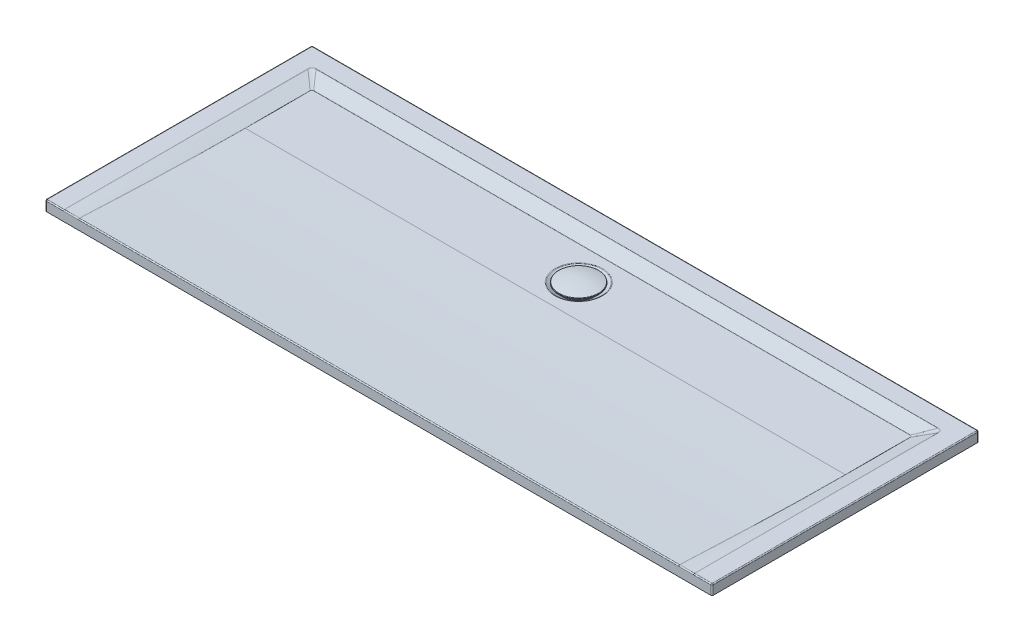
SolidWorks part; units mm, degrees
ref_plane "Płaszczyzna przednia" through (0, 0, 0) normal (0, 0, 1) x (1, 0, 0)
ref_plane "Płaszczyzna górna" through (0, 0, 0) normal (0, 1, 0) x (1, 0, 0)
ref_plane "Płaszczyzna prawa" through (0, 0, 0) normal (1, 0, 0) x (0, 0, -1)
sketch "Szkic1" plane through (0, 0, 0) normal (0, 1, 0) x (1, 0, 0)
  line L0 (0, 400) -> (0, -400) construction
  line L1 (-1000, 400) -> (1000, 400)
  line L2 (-1000, 400) -> (-1000, -400)
  line L3 (-1000, -400) -> (1000, -400)
  line L4 (1000, 400) -> (1000, -400)
  line L5 (-945, -400) -> (-945, 345)
  line L6 (-945, 345) -> (945, 345)
  line L7 (945, 345) -> (945, -400)
  line L8 (-900, -400) -> (-900, 300)
  line L9 (-900, 300) -> (900, 300)
  line L10 (900, 300) -> (900, -400)
  circle A0 centre (0, 200) radius 45
  circle A1 centre (0, 200) radius 70
  point P9 (0, 345)
  dimension "D6" = 90
  dimension "D7" = 140
  dimension "D1" = 2000
  dimension "D2" = 55
  dimension "D3" = 55
  dimension "D5" = 200
  dimension "D8" = 800
  dimension "D4" = 45
sketch "Szkic2" plane through (0, 0, 0) normal (0, 1, 0) x (1, 0, 0)
  line L0 (-1000, -400) -> (1000, -400) construction
  line L1 (1000, 400) -> (1000, -400) construction
  line L2 (945, 345) -> (945, -400) construction
  line L3 (-945, 345) -> (945, 345) construction
  line L4 (-1000, 400) -> (1000, 400) construction
  line L5 (-945, -400) -> (-945, 345) construction
  line L6 (-1000, 400) -> (-1000, -400) construction
  line L7 (-1000, -400) -> (-945, -400)
  line L8 (1000, 400) -> (1000, -400)
  line L9 (945, 345) -> (945, -400)
  line L10 (-945, 345) -> (945, 345)
  line L11 (-1000, 400) -> (1000, 400)
  line L12 (-945, -400) -> (-945, 345)
  line L13 (-1000, 400) -> (-1000, -400)
  line L14 (945, -400) -> (1000, -400)
surface "Powierzchnia-Płaszczyzna1" sketch "Szkic2"
ref_plane "Płaszczyzna1" through (0, -15, 0) normal (0, 1, 0) x (-1, 0, 0)
sketch "Szkic3" plane through (0, -15, 0) normal (0, 1, 0) x (-1, 0, 0)
  line L0 (900, -100) -> (-900, -100)
  line L1 (900, 400) -> (900, -300) construction
  line L2 (-900, -300) -> (-900, 400) construction
  line L3 (0, -100) -> (0, -300) construction
  line L4 (900, -300) -> (-900, -300) construction
  line L5 (-900, -300) -> (-900, -100)
  line L6 (900, -100) -> (900, -300)
  line L7 (900, -300) -> (-900, -300)
  circle A0 centre (0, -200) radius 70 construction
  circle A1 centre (0, -200) radius 70
  point P10 (0, -200)
surface "Powierzchnia-Płaszczyzna2" sketch "Szkic3"
sketch "Szkic4" plane through (0, 0, 0) normal (0, 1, 0) x (1, 0, 0)
  line L0 (900, -400) -> (-900, -400)
other "Granica-Powierzchnia1"
other "Granica-Powierzchnia2"
other "Granica-Powierzchnia3"
mirror "Lustro1" about plane through (0, 0, 0) normal (1, 0, 0)
sketch "Szkic5" plane through (0, 0, 0) normal (0, 1, 0) x (1, 0, 0)
  line L0 (1000, 400) -> (1000, -400) construction
  line L1 (-1000, 400) -> (1000, 400) construction
  line L2 (-1000, 400) -> (-1000, -400) construction
  line L3 (-1000, -400) -> (1000, -400) construction
  line L4 (1000, 400) -> (1000, -400)
  line L5 (-1000, 400) -> (1000, 400)
  line L6 (-1000, 400) -> (-1000, -400)
  line L7 (-1000, -400) -> (1000, -400)
surface "Powierzchnia-Wyciągnięcie1" sketch "Szkic5" parameters "D1"=30
sketch "Szkic7" plane through (0, 0, 0) normal (1, 0, 0) x (0, 0, -1)
  line L0 (200, 0) -> (200, -30) construction
  line L1 (400, -30) -> (-400, -30) construction
  line L2 (245, -30) -> (245, -28)
  line L3 (245, -28) -> (249, -28)
  line L6 (249, -28) -> (270, -15)
  dimension "D1" = 90
  dimension "D2" = 2
  dimension "D3" = 98
surface "Powierzchnia-Obrót wokół linii środkowej1" sketch "Szkic7" parameters "D1"=360
surface "Powierzchnia-Płaszczyzna3"
surface "Powierzchnia-Połącz1"
fillet "Zaokrąglenie1" radius 4 6 edges at (0, -28, -249) (0, -15, -130) (1000, -15, 400) (1000, -15, -400) (-1000, -15, -400) (-1000, -15, 400)
fillet "Zmienne zaokrąglenie1" radius 40 2 edges at (922.5, -7.5, -322.5)
fillet "Zaokrąglenie3" radius 3 12 edges
fillet "Zaokrąglenie4" radius 3 12 edges at (-998.8284, 0, -398.8284) (0, 0, -400) (998.8284, 0, -398.8284) (1000, 0, 0) (998.8284, 0, 398.8284) (970.5, 0, 400) (-970.5, 0, 400) (-998.8284, 0, 398.8284) (-1000, 0, 0)
sketch "Szkic8" plane through (0, 0, 0) normal (1, 0, 0) x (0, 0, -1)
  line L0 (200, 0) -> (200, -30) construction
  line L1 (200, -5.6601) -> (179.8469, -5.6601) construction
  line L2 (260, -14.7573) -> (260, -17)
  line L3 (260, -17) -> (200, -17)
  line L4 (200, -17) -> (200, -5.6601)
  line L5 (200, -5.6601) -> (199.9922, 95.6514)
  arc A0 (200, -5.6601) -> (259.2694, -13.7943) centre (200, -225.6601) cw
  arc A1 (259.2694, -13.7943) -> (260, -14.7573) centre (259, -14.7573) cw
  point P11 (260, -14)
  dimension "D1" = 220
  dimension "D4" = 1
  dimension "D2" = 60
  dimension "D3" = 3
  dimension "D5" = 13
revolve "Obrót wokół linii środkowej1" add sketch "Szkic8" angle 360 about L4
